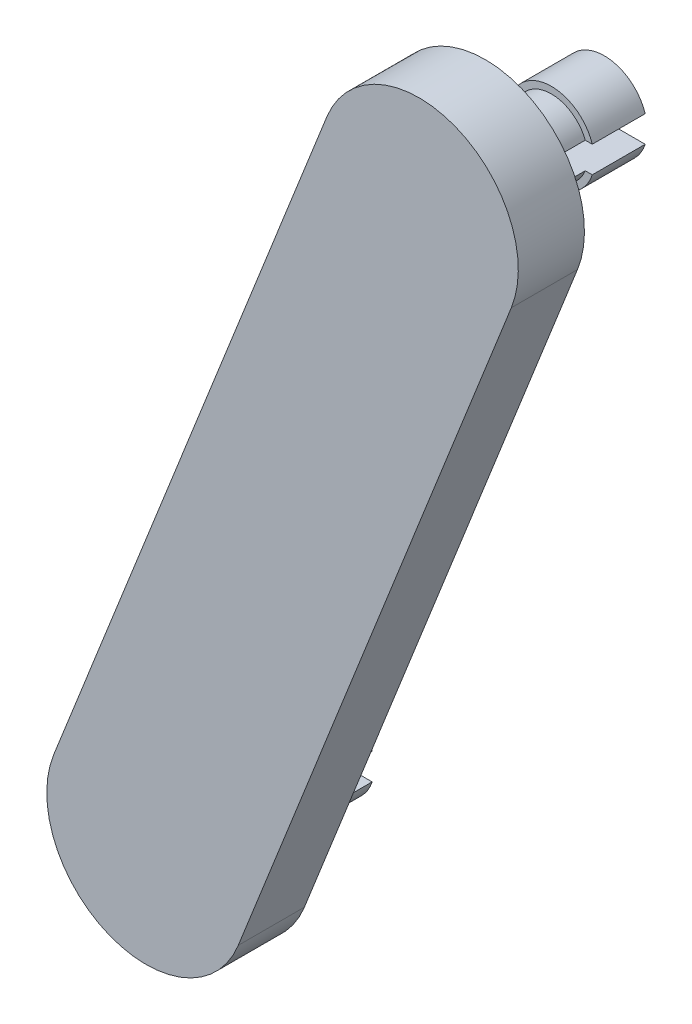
SolidWorks part; units mm, degrees
ref_plane "Plan de face" through (0, 0, 0) normal (0, 0, 1) x (1, 0, 0)
ref_plane "Plan de dessus" through (0, 0, 0) normal (0, 1, 0) x (1, 0, 0)
ref_plane "Plan de droite" through (0, 0, 0) normal (1, 0, 0) x (0, 0, -1)
sketch "Esquisse1" plane through (0, 0, 0) normal (0, 0, 1) x (1, 0, 0)
  line L0 (-138.3093, -40.0719) -> (-117.6698, 11.9859) construction
  line L1 (-145.2813, -37.3077) -> (-124.6419, 14.7501)
  line L2 (-131.3373, -42.8361) -> (-110.6978, 9.2216)
  arc A0 (-145.2813, -37.3077) -> (-131.3373, -42.8361) centre (-138.3093, -40.0719) ccw
  arc A1 (-110.6978, 9.2216) -> (-124.6419, 14.7501) centre (-117.6698, 11.9859) ccw
  point P4 (-127.9896, -14.043)
  dimension "D1" = 15
extrude "Boss.-Extru.1" add sketch "Esquisse1" along normal blind 5
sketch "Esquisse3" plane through (0, 0, 0) normal (0, 0, 1) x (1, 0, 0)
  circle A0 centre (-117.6698, 11.9859) radius 2.75
  circle A1 centre (-138.3093, -40.0719) radius 2.75
  dimension "D1" = 5.5
  dimension "D2" = 5.5
extrude "Boss.-Extru.2" add sketch "Esquisse3" against normal blind 5
sketch "Esquisse4" plane through (0, 0, -5) normal (0, 0, -1) x (-1, 0, 0)
  circle A0 centre (117.6698, 11.9859) radius 3.25
  circle A1 centre (138.3093, -40.0719) radius 3.25
  dimension "D1" = 6.5
  dimension "D2" = 6.5
extrude "Boss.-Extru.3" add sketch "Esquisse4" along normal blind 4
sketch "Esquisse5" plane through (0, 0, -9) normal (0, 0, -1) x (-1, 0, 0)
  line L1 (133.3093, -39.0719) -> (143.3093, -39.0719)
  line L2 (133.3093, -39.0719) -> (133.3093, -41.0719)
  line L3 (133.3093, -41.0719) -> (143.3093, -41.0719)
  line L4 (143.3093, -39.0719) -> (143.3093, -41.0719)
  line L5 (112.6698, 12.9859) -> (122.6698, 12.9859)
  line L6 (112.6698, 12.9859) -> (112.6698, 10.9859)
  line L7 (112.6698, 10.9859) -> (122.6698, 10.9859)
  line L8 (122.6698, 12.9859) -> (122.6698, 10.9859)
  dimension "D1" = 1
  dimension "D2" = 1
  dimension "D3" = 10
  dimension "D4" = 5
  dimension "D5" = 1
  dimension "D6" = 1
  dimension "D7" = 10
  dimension "D8" = 5
extrude "Enlèv. mat.-Extru.1" cut sketch "Esquisse5" against normal blind 9
